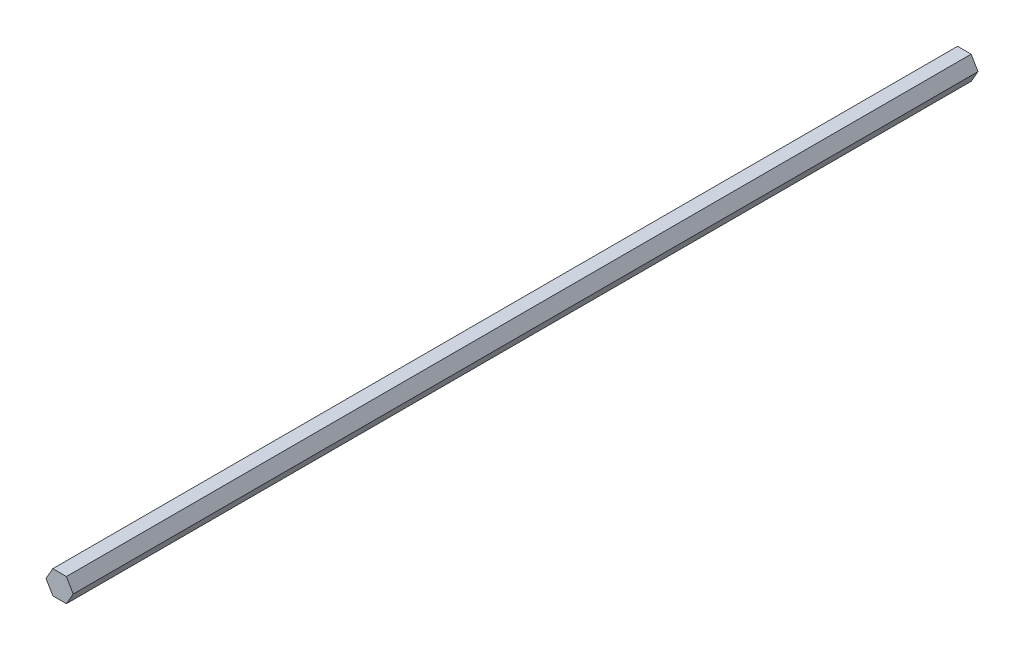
SolidWorks part; units mm, degrees
ref_plane "Plane1" through (0, 0, 0) normal (0, 0, 1) x (1, 0, 0)
ref_plane "Plane2" through (0, 0, 0) normal (0, 1, 0) x (1, 0, 0)
ref_plane "Plane3" through (0, 0, 0) normal (1, 0, 0) x (0, 0, -1)
sketch "Sketch1" plane through (0, 0, 0) normal (0, 0, 1) x (1, 0, 0)
  line L1 (4.5827, 0) -> (2.2914, 3.9688)
  line L2 (2.2914, 3.9688) -> (-2.2914, 3.9688)
  line L3 (-2.2914, 3.9688) -> (-4.5827, 0)
  line L4 (-4.5827, 0) -> (-2.2914, -3.9688)
  line L5 (-2.2914, -3.9688) -> (2.2914, -3.9688)
  line L6 (2.2914, -3.9688) -> (4.5827, 0)
  circle A0 centre (0, 0) radius 3.9688 construction
  dimension "D1" = 7.9375
extrude "Base-Extrude" add sketch "Sketch1" along normal blind 304.8
